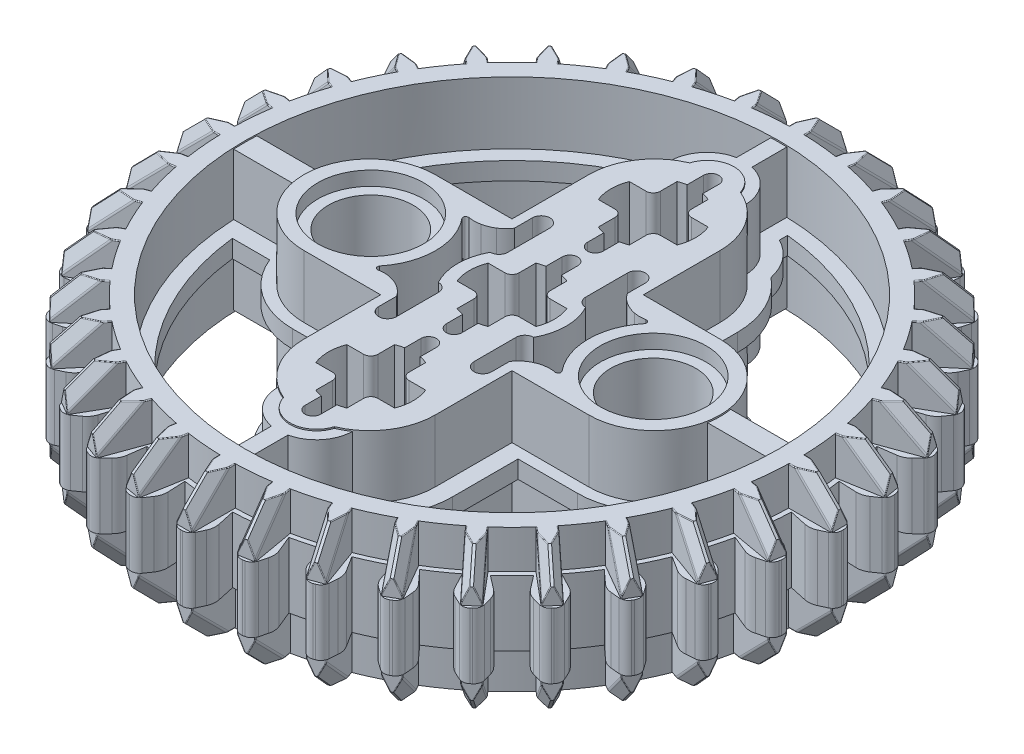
SolidWorks part; units mm, degrees
ref_plane "Front Plane" through (0, 0, 0) normal (0, 0, 1) x (1, 0, 0)
ref_plane "Top Plane" through (0, 0, 0) normal (0, 1, 0) x (1, 0, 0)
ref_plane "Right Plane" through (0, 0, 0) normal (1, 0, 0) x (0, 0, -1)
imported_body "Imported1"
sketch "Sketch1" plane through (0, 4.0325, 0) normal (0, 1, 0) x (1, 0, 0)
  line L0 (-8.07, 3.72) -> (-3.72, 3.72)
  line L1 (-3.72, 3.72) -> (-3.72, 8.07)
  line L2 (3.72, 8.07) -> (3.72, 3.72)
  line L3 (3.72, 3.72) -> (8.07, 3.72)
  line L4 (8.07, -3.72) -> (3.72, -3.72)
  line L5 (3.72, -3.72) -> (3.72, -8.07)
  line L6 (-3.72, -8.07) -> (-3.72, -3.72)
  line L7 (-3.72, -3.72) -> (-8.07, -3.72)
  line L8 (-2.2, 4.35) -> (-2.2, 1.9715)
  line L9 (-2.7, 1.4715) -> (-3.075, 0)
  line L10 (-3.075, 0) -> (-2.7, -1.4715)
  line L11 (-3.2, 4.35) -> (-3.2, 3.3377)
  line L12 (-2.2, -1.9715) -> (-2.2, -4.35)
  line L13 (-3.2, -3.3377) -> (-3.2, -4.35)
  line L14 (0, 0) -> (0, 4.015) construction
  line L15 (3.2, -3.3377) -> (3.2, -4.35)
  line L16 (2.2, -1.9715) -> (2.2, -4.35)
  line L17 (3.2, 4.35) -> (3.2, 3.3377)
  line L18 (3.075, 0) -> (2.7, -1.4715)
  line L19 (2.7, 1.4715) -> (3.075, 0)
  line L20 (2.2, 4.35) -> (2.2, 1.9715)
  arc A0 (-8.07, 3.72) -> (-8.07, -3.72) centre (-8.07, 0) ccw
  arc A1 (8.07, 3.72) -> (8.07, -3.72) centre (8.07, 0) cw
  arc A2 (3.72, 8.07) -> (-3.72, 8.07) centre (0, 8.07) ccw
  arc A3 (-3.72, -8.07) -> (3.72, -8.07) centre (0, -8.07) ccw
  arc A4 (-2.2, 1.9715) -> (-2.7, 1.4715) centre (-2.7, 1.9715) cw
  arc A5 (-2.7, 1.4715) -> (-2.7, -1.4715) centre (0, 0) ccw construction
  arc A6 (-2.2, 4.35) -> (-3.2, 4.35) centre (-2.7, 4.35) ccw
  arc A7 (-3.2, -4.35) -> (-2.2, -4.35) centre (-2.7, -4.35) ccw
  arc A8 (-2.2, -1.9715) -> (-2.7, -1.4715) centre (-2.7, -1.9715) ccw
  arc A9 (-5.1645, -2.3292) -> (-5.1645, 2.3292) centre (-8, 0) ccw
  arc A10 (-5.0176, 2.5756) -> (-3.2, 3.3377) centre (-4.693, 4.35) ccw construction
  arc A11 (-3.2, -3.3377) -> (-5.0176, -2.5756) centre (-4.693, -4.35) ccw construction
  arc A12 (-5.0176, 2.5756) -> (-5.1645, 2.3292) centre (-5.0451, 2.4251) ccw construction
  arc A13 (-5.1645, -2.3292) -> (-5.0176, -2.5756) centre (-5.0451, -2.4251) ccw construction
  arc A14 (5.1645, -2.3292) -> (5.1645, 2.3292) centre (8, 0) cw
  arc A15 (2.2, -1.9715) -> (2.7, -1.4715) centre (2.7, -1.9715) cw
  arc A16 (3.2, -4.35) -> (2.2, -4.35) centre (2.7, -4.35) cw
  arc A17 (2.2, 4.35) -> (3.2, 4.35) centre (2.7, 4.35) cw
  arc A18 (2.2, 1.9715) -> (2.7, 1.4715) centre (2.7, 1.9715) ccw
  spline S0 degree 3 poles (-5.0176, 2.5756) (-4.3316, 2.4419) (-3.5858, 2.7527) (-3.2, 3.3377) knots 0 0 0 0 1 1 1 1
  spline S1 degree 3 poles (-3.2, -3.3377) (-3.5862, -2.7528) (-4.3308, -2.4418) (-5.0176, -2.5756) knots 0 0 0 0 1 1 1 1
  spline S2 degree 2 poles (-5.0176, 2.5756) (-5.2622, 2.5544) (-5.1645, 2.3292) knots 0 0 0 1 1 1
  spline S3 degree 2 poles (-5.0176, -2.5756) (-5.2622, -2.5544) (-5.1645, -2.3292) knots 0 0 0 1 1 1
  spline S4 degree 2 poles (5.0176, -2.5756) (5.2622, -2.5544) (5.1645, -2.3292) knots 0 0 0 1 1 1
  spline S5 degree 2 poles (5.0176, 2.5756) (5.2622, 2.5544) (5.1645, 2.3292) knots 0 0 0 1 1 1
  spline S6 degree 3 poles (3.2, -3.3377) (3.5862, -2.7528) (4.3308, -2.4418) (5.0176, -2.5756) knots 0 0 0 0 1 1 1 1
  spline S7 degree 3 poles (5.0176, 2.5756) (4.3316, 2.4419) (3.5858, 2.7527) (3.2, 3.3377) knots 0 0 0 0 1 1 1 1
  point P56 (-8, 0)
  dimension "D1" = 8
extrude "Boss-Extrude1" add sketch "Sketch1" against normal up to surface (8.065 mm away)
sketch "Sketch2" plane through (0, 4.0325, 0) normal (0, 1, 0) x (1, 0, 0)
  line L0 (-0.88, 10.2328) -> (-0.88, 9.28)
  line L1 (0.88, 10.2328) -> (0.88, 9.28)
  line L2 (-2.2328, 0.88) -> (-1.28, 0.88)
  line L3 (-2.2328, -0.88) -> (-1.28, -0.88)
  line L4 (-2.2328, 8.88) -> (-1.28, 8.88)
  line L5 (-2.2328, -7.12) -> (-1.28, -7.12)
  line L6 (-2.2328, 7.12) -> (-1.28, 7.12)
  line L7 (2.2328, -8.88) -> (1.28, -8.88)
  line L8 (1.28, 8.88) -> (2.2328, 8.88)
  line L9 (1.28, 7.12) -> (2.2328, 7.12)
  line L10 (-0.88, 6.72) -> (-0.88, 5.7672)
  line L11 (0.88, 6.72) -> (0.88, 5.7672)
  line L12 (-0.88, 2.2328) -> (-0.88, 1.28)
  line L13 (0.88, 2.2328) -> (0.88, 1.28)
  line L14 (1.28, 0.88) -> (2.2328, 0.88)
  line L15 (1.28, -0.88) -> (2.2328, -0.88)
  line L16 (-0.88, -1.28) -> (-0.88, -2.2328)
  line L17 (0.88, -1.28) -> (0.88, -2.2328)
  line L18 (0.88, -5.7672) -> (0.88, -6.72)
  line L19 (-0.88, -5.7672) -> (-0.88, -6.72)
  line L20 (-0.88, -9.28) -> (-0.88, -10.2328)
  line L21 (1.28, -7.12) -> (2.2328, -7.12)
  line L22 (0.88, -9.28) -> (0.88, -10.2328)
  line L23 (-1.28, -8.88) -> (-2.2328, -8.88)
  line L29 (-0.44, 3.28) -> (-0.44, 2.3593)
  line L31 (0.44, -11.28) -> (0.44, -10.3593)
  line L35 (-0.44, -4.72) -> (-0.44, -5.6407)
  line L36 (0.44, -3.28) -> (0.44, -2.3593)
  line L37 (-0.44, -2.3593) -> (-0.44, -3.28)
  line L38 (0.44, 2.3593) -> (0.44, 3.28)
  line L39 (-0.44, -10.3593) -> (-0.44, -11.28)
  line L40 (0.44, -5.6407) -> (0.44, -4.72)
  line L41 (-0.44, 10.3593) -> (-0.44, 11.28)
  line L42 (0.44, 5.6407) -> (0.44, 4.72)
  line L43 (0.44, 11.28) -> (0.44, 10.3593)
  line L44 (-0.44, 4.72) -> (-0.44, 5.6407)
  line L45 (0, 8) -> (0.44, 10.3593) construction
  circle A0 centre (8, 0) radius 2.4
  circle A1 centre (-8, 0) radius 2.4
  arc A2 (-2.2328, 0.88) -> (-2.2328, -0.88) centre (0, 0) ccw
  arc A3 (0.88, 10.2328) -> (0.44, 10.3593) centre (0, 8) ccw
  arc A4 (-2.2328, -7.12) -> (-2.2328, -8.88) centre (0, -8) ccw
  arc A5 (-2.2328, 8.88) -> (-2.2328, 7.12) centre (0, 8) ccw
  arc A6 (-0.88, 5.7672) -> (-0.44, 5.6407) centre (0, 8) ccw
  arc A7 (2.2328, 7.12) -> (2.2328, 8.88) centre (0, 8) ccw
  arc A8 (0.88, 2.2328) -> (0.44, 2.3593) centre (0, 0) ccw
  arc A9 (-0.88, -2.2328) -> (-0.44, -2.3593) centre (0, 0) ccw
  arc A10 (2.2328, -0.88) -> (2.2328, 0.88) centre (0, 0) ccw
  arc A11 (0.88, -5.7672) -> (0.44, -5.6407) centre (0, -8) ccw
  arc A12 (2.2328, -8.88) -> (2.2328, -7.12) centre (0, -8) ccw
  arc A13 (-0.88, -10.2328) -> (-0.44, -10.3593) centre (0, -8) ccw
  arc A14 (-0.88, -9.28) -> (-1.28, -8.88) centre (-1.28, -9.28) ccw
  arc A15 (0.88, -9.28) -> (1.28, -8.88) centre (1.28, -9.28) cw
  arc A16 (1.28, -7.12) -> (0.88, -6.72) centre (1.28, -6.72) cw
  arc A17 (-0.88, -6.72) -> (-1.28, -7.12) centre (-1.28, -6.72) cw
  arc A18 (1.28, 0.88) -> (0.88, 1.28) centre (1.28, 1.28) cw
  arc A19 (1.28, -0.88) -> (0.88, -1.28) centre (1.28, -1.28) ccw
  arc A20 (-1.28, -0.88) -> (-0.88, -1.28) centre (-1.28, -1.28) cw
  arc A21 (-1.28, 0.88) -> (-0.88, 1.28) centre (-1.28, 1.28) ccw
  arc A22 (-1.28, 7.12) -> (-0.88, 6.72) centre (-1.28, 6.72) cw
  arc A23 (1.28, 7.12) -> (0.88, 6.72) centre (1.28, 6.72) ccw
  arc A24 (1.28, 8.88) -> (0.88, 9.28) centre (1.28, 9.28) cw
  arc A25 (-0.88, 9.28) -> (-1.28, 8.88) centre (-1.28, 9.28) cw
  arc A26 (-0.44, 10.3593) -> (-0.88, 10.2328) centre (0, 8) ccw
  arc A29 (0.44, 5.6407) -> (0.88, 5.7672) centre (0, 8) ccw
  arc A30 (0.44, -2.3593) -> (0.88, -2.2328) centre (0, 0) ccw
  arc A31 (-0.44, 2.3593) -> (-0.88, 2.2328) centre (0, 0) ccw
  arc A32 (0.44, -10.3593) -> (0.88, -10.2328) centre (0, -8) ccw
  arc A33 (-0.44, -5.6407) -> (-0.88, -5.7672) centre (0, -8) ccw
  arc A34 (-0.44, 3.28) -> (0.44, 3.28) centre (0, 3.28) cw
  arc A35 (-0.44, -3.28) -> (0.44, -3.28) centre (0, -3.28) ccw
  arc A36 (-0.44, -4.72) -> (0.44, -4.72) centre (0, -4.72) cw
  arc A37 (-0.44, -11.28) -> (0.44, -11.28) centre (0, -11.28) ccw
  arc A38 (-0.44, 11.28) -> (0.44, 11.28) centre (0, 11.28) cw
  arc A39 (0.44, 4.72) -> (-0.44, 4.72) centre (0, 4.72) cw
  point P8 (0, 0)
  point P48 (-0.88, -8.88)
  point P59 (0.88, -0.88)
  point P62 (-0.88, -0.88)
  point P67 (-0.88, 7.12)
  point P70 (0.88, 7.12)
  point P76 (0, 0)
  point P81 (0, 0)
  point P84 (-0.0222, -2.7617)
  point P88 (0, 8)
  dimension "D1" = 8
  dimension "D3" = 0.88
  dimension "D7" = 8
  dimension "D13" = 0.4
  dimension "D4" = 1.76
  dimension "D5" = 0.88
  dimension "D6" = 1.76
  dimension "D8" = 8
  dimension "D9" = 0.88
  dimension "D10" = 1.76
  dimension "D11" = 0.88
  dimension "D12" = 1.76
  dimension "D14" = 0.88
  dimension "D15" = 0.44
  dimension "D16" = 2
  dimension "D17" = 0.44
  dimension "D18" = 0.88
  dimension "D19" = 2.4
  dimension "D20" = 3.28
  dimension "D21" = 3.28
  dimension "D22" = 3.28
  dimension "D23" = 3.28
  dimension "D2" = 2
extrude "Cut-Extrude1" cut sketch "Sketch2" against normal up to surface (8.065 mm away)
sketch "Sketch3" plane through (0, 4.0325, 0) normal (0, 1, 0) x (1, 0, 0)
  circle A0 centre (-8, 0) radius 3
  circle A1 centre (8, 0) radius 3
extrude "Cut-Extrude2" cut sketch "Sketch3" against normal blind 0.8
